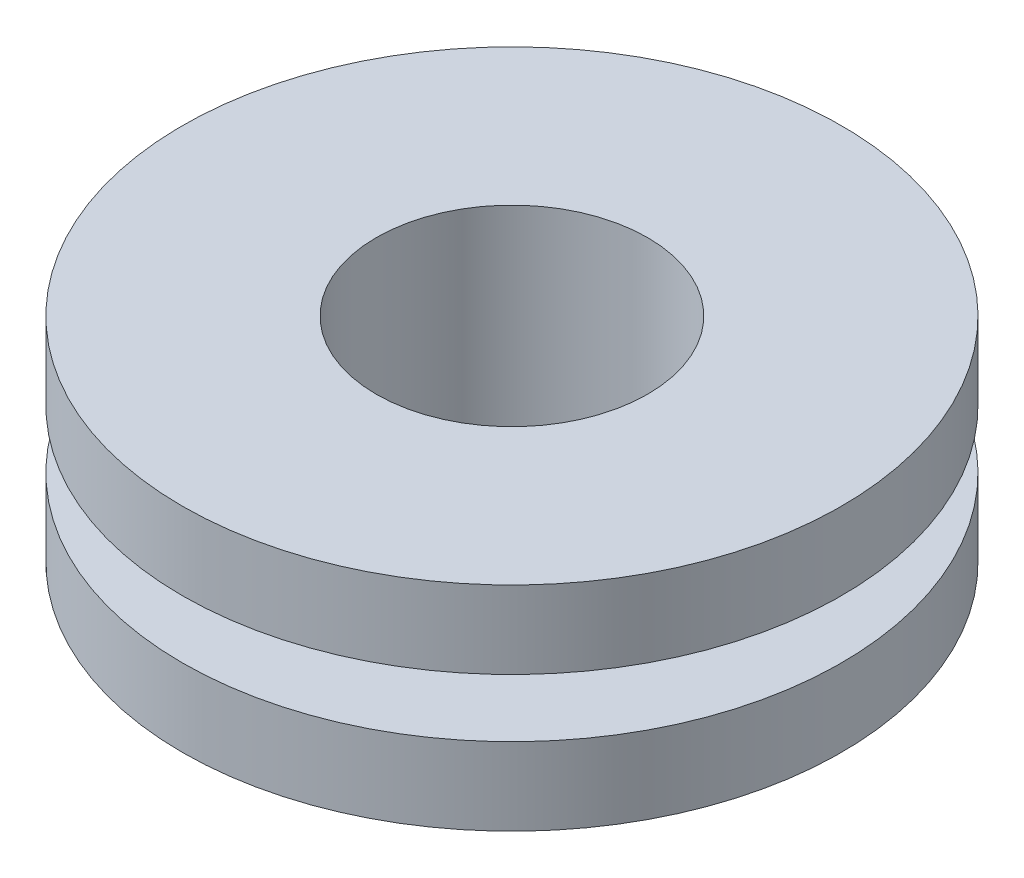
SolidWorks part; units mm, degrees
ref_plane "Спереди" through (0, 0, 0) normal (0, 0, 1) x (1, 0, 0)
ref_plane "Сверху" through (0, 0, 0) normal (0, 1, 0) x (1, 0, 0)
ref_plane "Справа" through (0, 0, 0) normal (1, 0, 0) x (0, 0, -1)
sketch "Эскиз1" plane through (0, 0, 0) normal (0, 1, 0) x (1, 0, 0)
  circle A0 centre (0, 0) radius 8.5
extrude "Бобышка-Вытянуть1" add sketch "Эскиз1" along normal blind 2
sketch "Эскиз2" plane through (0, 2, 0) normal (0, 1, 0) x (1, 0, 0)
  circle A0 centre (0, 0) radius 5.5
extrude "Бобышка-Вытянуть2" add sketch "Эскиз2" along normal blind 1.5
sketch "Эскиз3" plane through (0, 3.5, 0) normal (0, 1, 0) x (1, 0, 0)
  circle A0 centre (0, 0) radius 8.5
extrude "Бобышка-Вытянуть3" add sketch "Эскиз3" along normal blind 2
sketch "Эскиз4" plane through (0, 5.5, 0) normal (0, 1, 0) x (1, 0, 0)
  circle A0 centre (0, 0) radius 3.5
extrude "Вырез-Вытянуть1" cut sketch "Эскиз4" against normal up to surface (5.5 mm away)
